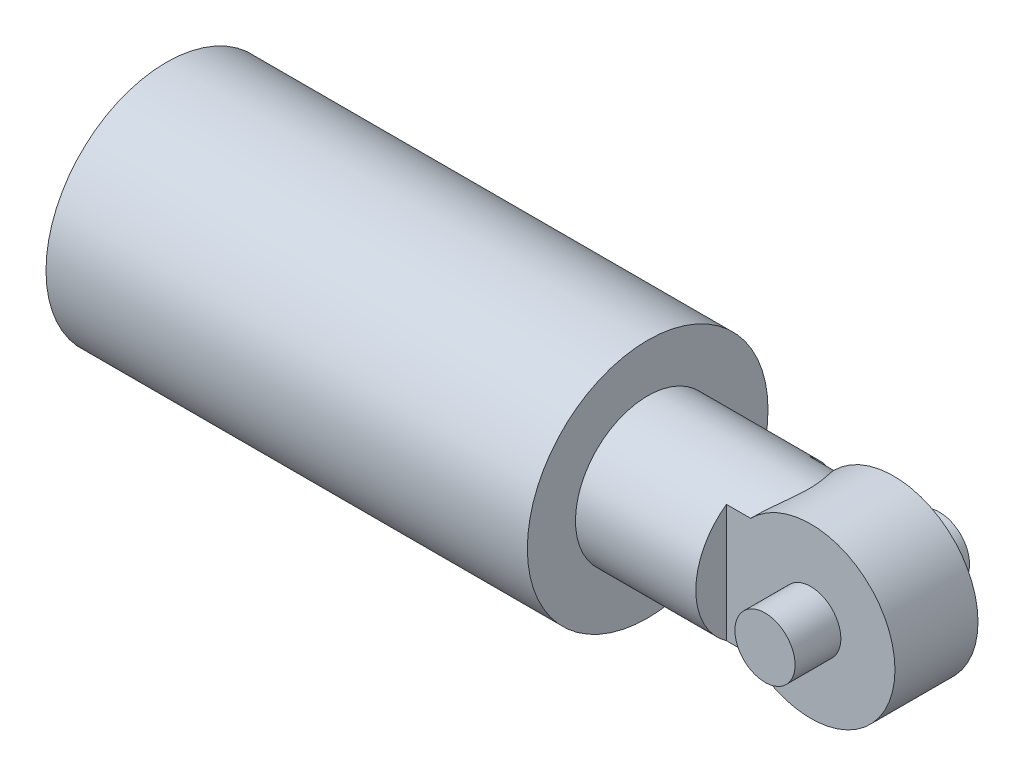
SolidWorks part; units mm, degrees
ref_plane "Alzado" through (0, 0, 0) normal (0, 0, 1) x (1, 0, 0)
ref_plane "Planta" through (0, 0, 0) normal (0, 1, 0) x (1, 0, 0)
ref_plane "Vista lateral" through (0, 0, 0) normal (1, 0, 0) x (0, 0, -1)
sketch "Croquis1" plane through (0, 0, 0) normal (0, 0, 1) x (1, 0, 0)
  line L0 (0, 0) -> (0, -18.6472) construction
  circle A0 centre (7, -2.6652) radius 2.5
  circle A2 centre (7, -2.6652) radius 7
  dimension "D1" = 14
extrude "Saliente-Extruir1" add sketch "Croquis1" along normal mid plane 6.9
sketch "Croquis46" plane through (0, 0, 0) normal (0, 0, 1) x (1, 0, 0)
  circle A0 centre (7, -2.6652) radius 7 construction
  circle A1 centre (7, -2.6652) radius 2.5
extrude "Saliente-Extruir3" add sketch "Croquis46" along normal mid plane 14.5
sketch "Croquis47" plane through (0, 0, 0) normal (1, 0, 0) x (0, 0, -1)
  line L0 (-2.5, -2.6652) -> (-2.5, -10.9458)
  line L2 (-2.5, -10.9458) -> (2.5, -10.9458)
  line L3 (2.5, -10.9458) -> (2.5, -2.6652)
  arc A1 (2.5, -2.6652) -> (-2.5, -2.6652) centre (0, -2.6652) ccw
sketch "Croquis48" plane through (0, 0, 0) normal (1, 0, 0) x (0, 0, -1)
  circle A0 centre (0, -2.6652) radius 6
  point P2 (0, 0)
extrude "Saliente-Extruir4" add sketch "Croquis48" against normal blind 10
sketch "Croquis52" plane through (-10, 0, 0) normal (-1, 0, 0) x (0, 0, 1)
  line L0 (0, -2.7108) -> (0, 6.3348)
ref_plane "Plano1" through (-10, 0, 0) normal (-1, 0, 0) x (0, 0, 1)
sketch "Croquis101" plane through (-10, 0, 0) normal (-1, 0, 0) x (0, 0, 1)
  circle A0 centre (0, -2.6652) radius 10
extrude "Saliente-Extruir5" add sketch "Croquis101" along normal blind 40 contours A0
sketch "Croquis114" plane through (-50, 0, 0) normal (-1, 0, 0) x (0, 0, 1)
  circle A0 centre (0, -2.6652) radius 5
sketch "Croquis116" plane through (0, 0, 0) normal (1, 0, 0) x (0, 0, -1)
  circle A1 centre (0, -2.6652) radius 6
  circle A3 centre (0, -2.6652) radius 6
  dimension "D1" = 0
ref_plane "Plano2" through (0, 0, 0) normal (0, 1, 0) x (1, 0, 0)
sketch "Croquis117" plane through (0, 0, 0) normal (1, 0, 0) x (0, 0, -1)
  line L0 (3.45, 2.2437) -> (3.45, -7.5742)
  line L1 (3.45, -9.6652) -> (3.45, 4.3348) construction
  line L2 (-3.45, 2.2437) -> (-3.45, -7.5742)
  line L3 (-3.45, 4.3348) -> (-3.45, -9.6652) construction
  arc A0 (-3.45, -7.5742) -> (3.45, -7.5742) centre (0, -2.6652) ccw
  circle A1 centre (0, -2.6652) radius 6
  arc A2 (3.45, 2.2437) -> (-3.45, 2.2437) centre (0, -2.6652) ccw
  point P11 (0, 0)
  dimension "D1" = 0
extrude "Saliente-Extruir6" add sketch "Croquis117" along normal up to surface
